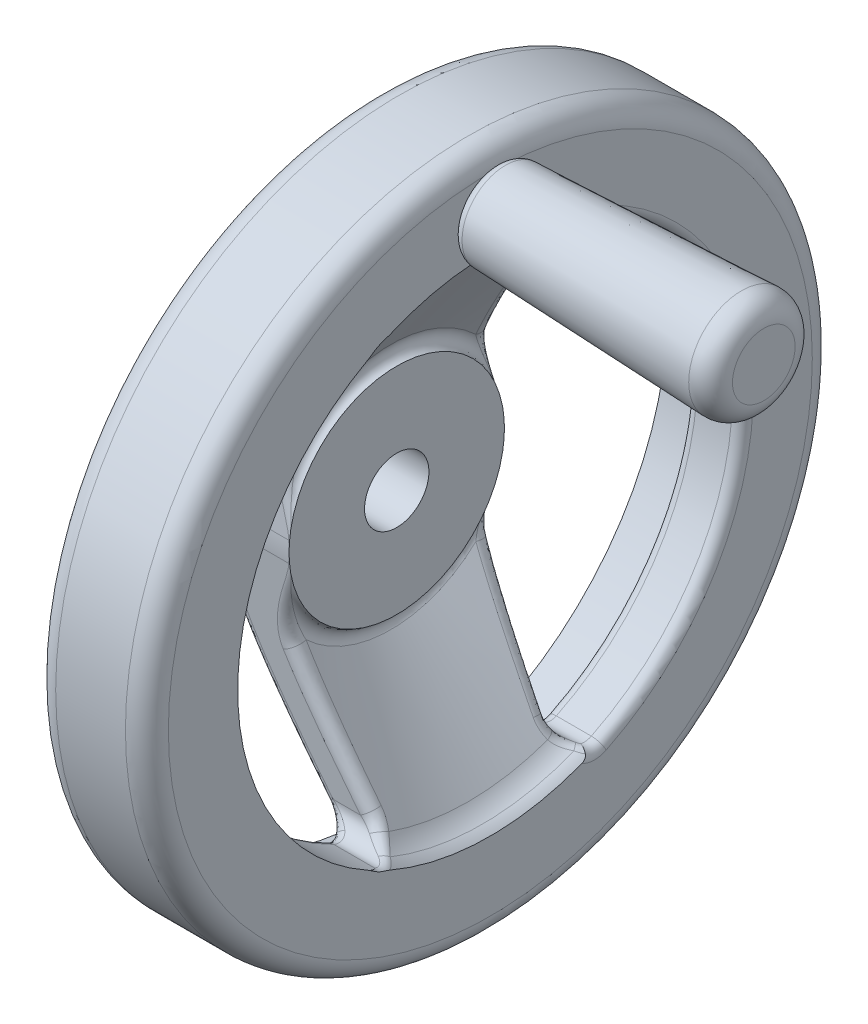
SolidWorks part; units mm, degrees
ref_plane "Plane1" through (0, 0, 0) normal (0, 0, 1) x (1, 0, 0)
ref_plane "Plane2" through (0, 0, 0) normal (0, 1, 0) x (1, 0, 0)
ref_plane "Plane3" through (0, 0, 0) normal (1, 0, 0) x (0, 0, -1)
sketch "Sketch1" plane through (0, 0, 0) normal (0, 0, 1) x (1, 0, 0)
  line L0 (14.6387, 15.875) -> (15.1122, 15.875)
  line L1 (0.7925, 15.0812) -> (14.6387, 15.0812)
  line L2 (14.6387, 15.875) -> (14.6387, 15.0812)
  line L3 (0, 0) -> (26.1925, 0) construction
  line L4 (36.7677, 34.5985) -> (25.3366, 18.2731)
  line L5 (31.3041, 37.8664) -> (16.3606, 16.5249)
  line L6 (23.3731, 42.8625) -> (28.7032, 42.8625)
  line L7 (0, 4.7625) -> (26.1925, 4.7625)
  line L340 (26.5481, 50.8) -> (36.8605, 50.8)
  line L342 (40.0355, 47.625) -> (40.0355, 37.3713)
  line L343 (23.3731, 47.625) -> (23.3731, 42.8625)
  line L344 (26.1925, 15.9264) -> (26.1925, 4.7625)
  line L345 (0, 14.2888) -> (0, 4.7625)
  line L346 (0, 14.2888) -> (0.7925, 15.0812)
  arc A2 (38.8212, 36.4709) -> (36.7677, 34.5985) centre (41.9694, 30.9562) ccw
  arc A3 (38.8212, 36.4709) -> (40.0355, 37.3713) centre (35.673, 41.9856) ccw
  arc A5 (31.3041, 37.8664) -> (28.7032, 42.8625) centre (28.7032, 39.6875) ccw
  arc A6 (15.1122, 15.875) -> (16.3606, 16.5249) centre (15.1122, 17.399) ccw
  arc A7 (25.3366, 18.2731) -> (26.1925, 15.9264) centre (26.585, 17.399) ccw
  arc A62 (26.5481, 50.8) -> (23.3731, 47.625) centre (26.5481, 47.625) ccw
  arc A63 (40.0355, 47.625) -> (36.8605, 50.8) centre (36.8605, 47.625) ccw
  dimension "D10" = 5.3302
  dimension "D11" = 9.525
  dimension "D12" = 6.35
  dimension "D13" = 6.35
  dimension "D15" = 1.524
  dimension "D18" = 0.7925
  dimension "D19" = 15.1122
  dimension "D14" = 3.175
  dimension "D16" = 1.524
  dimension "D17" = 3.175
  dimension "D1" = 101.6
  dimension "D2" = 30.1625
  dimension "D3" = 26.1925
  dimension "D4" = 13.843
  dimension "D5" = 16.6624
  dimension "D6" = 85.725
  dimension "D7" = 6.35
  dimension "D8" = 35
  dimension "D9" = 14.6387
  dimension "D20" = 35.673
  dimension "D21" = 36.7677
  dimension "D22" = 14.2888
revolve "Base-Revolve" add sketch "Sketch1" angle 360 about L3
sketch "Sketch2" plane through (23.3731, 0, 0) normal (-1, 0, 0) x (0, 0, 1)
  line L0 (0, 0) -> (0, 44.45) construction
  arc A0 (-6.0226, 42.4373) -> (6.0226, 42.4373) centre (0, 44.45) ccw
  circle A1 centre (0, 0) radius 42.8625 construction
  arc A2 (6.0226, 42.4373) -> (-6.0226, 42.4373) centre (0, 0) ccw
  dimension "D1" = 6.35
  dimension "D2" = 6.0226
extrude "Boss-Extrude1" add sketch "Sketch2" against normal up to next
sketch "Sketch4"
  line L0 (-15.8568, 1.4871) -> (-13.0693, 31.2091)
  line L1 (0, 0) -> (0, 59.9525) construction
  line L2 (0, 0) -> (-61.3556, 0) construction
  line L3 (15.8568, 1.4871) -> (13.0693, 31.2091)
  line L4 (15.8568, -1.4871) -> (13.0693, -31.2091)
  line L5 (-15.8568, -1.4871) -> (-13.0693, -31.2091)
  circle A0 centre (0, 0) radius 37.3713 construction
  arc A1 (-16.4617, 33.5503) -> (-16.4617, -33.5503) centre (0, 0) ccw
  circle A2 centre (0, 0) radius 15.9264 construction
  arc A3 (-15.8568, 1.4871) -> (-15.8568, -1.4871) centre (0, 0) ccw
  arc A4 (15.8568, -1.4871) -> (15.8568, 1.4871) centre (0, 0) ccw
  arc A5 (16.4617, -33.5503) -> (16.4617, 33.5503) centre (0, 0) ccw
  arc A6 (-13.0693, 31.2091) -> (-16.4617, 33.5503) centre (-15.4212, 31.4297) ccw
  arc A7 (-13.0693, -31.2091) -> (-16.4617, -33.5503) centre (-15.4212, -31.4297) cw
  arc A8 (16.4617, -33.5503) -> (13.0693, -31.2091) centre (15.4212, -31.4297) cw
  arc A9 (16.4617, 33.5503) -> (13.0693, 31.2091) centre (15.4212, 31.4297) ccw
  point P15 (-12.7, 35.1472)
  point P18 (-12.7, -35.1472)
  point P21 (12.7, -35.1472)
  point P24 (12.7, 35.1472)
  dimension "D2" = 2.3622
  dimension "D1" = 12.7
revolve "Boss-Revolve1" add sketch "Sketch3" angle 360 about L0
sketch "Sketch3" plane through (0, 0, 0) normal (0, 0, 1) x (1, 0, 0)
  line L0 (33.1866, 43.2587) -> (80.485, 43.2587) construction
  line L1 (38.1249, 43.2587) -> (38.1249, 47.2592)
  line L2 (38.1249, 47.2592) -> (40.7975, 47.2592)
  line L3 (40.7975, 47.2592) -> (40.7975, 48.1445)
  line L4 (42.2606, 49.6673) -> (77.1831, 51.0642)
  line L5 (80.485, 47.8917) -> (80.485, 43.2587)
  line L6 (40.0355, -47.625) -> (40.0355, 47.625) construction
  line L7 (80.485, 43.2587) -> (38.1249, 43.2587)
  arc A0 (80.485, 47.8917) -> (77.1831, 51.0642) centre (77.31, 47.8917) ccw
  arc A1 (42.2606, 49.6673) -> (40.7975, 48.1445) centre (42.3215, 48.1445) ccw
  point P12 (80.485, 51.1962)
  point P15 (40.7975, 49.6087)
  dimension "D7" = 3.175
  dimension "D8" = 1.524
  dimension "D1" = 43.2587
  dimension "D2" = 8.001
  dimension "D3" = 0.762
  dimension "D4" = 12.7
  dimension "D5" = 15.875
  dimension "D6" = 39.6875
  dimension "D9" = 42.3601
extrude "Cut-Extrude1" cut sketch "Sketch4" against normal through all
fillet "Fillet1" radius 1.524 36 edges at (15.6945, -2.9126, 15.7232) (15.5047, 0, 15.9264) (15.9035, 3.811, 15.6389) (30.9574, 0, 37.3713) (30.4055, -33.5958, 14.479) (30.397, 33.5892, 14.4639) (37.4513, 32.7578, 13.4677) (39.7418, 33.7905, 15.3421) (37.5457, -32.8362, 13.5234) (39.8195, -33.7905, 15.5009) (25.1142, 9.3977, 15.1149) (18.0239, 11.6198, 14.9065) (25.2634, -6.2873, 15.4066) (15.9035, -3.811, -15.6389) (15.5047, 0, -15.9264) (15.6945, 2.9126, -15.7232) (30.397, -33.5892, -14.4639) (30.9574, 0, -37.3713) (30.4055, 33.5958, -14.479) (37.5457, 32.8362, -13.5234) (39.8195, 33.7905, -15.5009) (37.4513, -32.7578, -13.4677) (39.7418, -33.7905, -15.3421) (25.2634, 6.2873, -15.4066) (25.1142, -9.3977, -15.1149) (18.0239, -11.6198, -14.9065)
